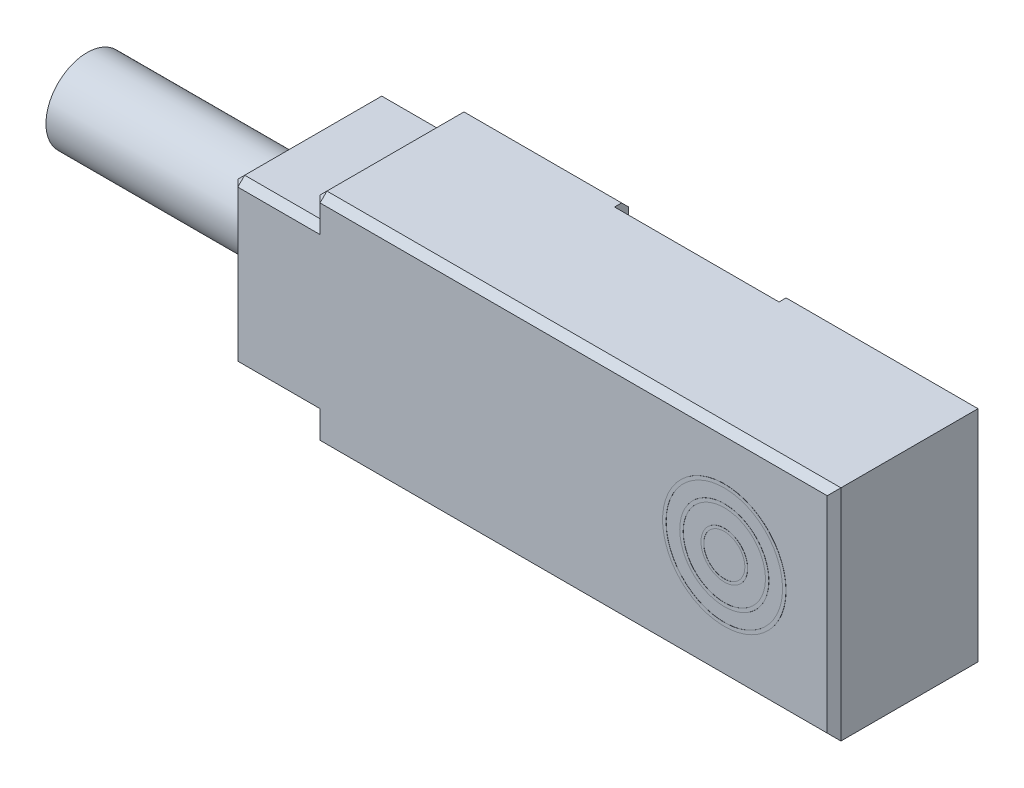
SolidWorks part; units mm, degrees
ref_plane "Front" through (0, 0, 0) normal (0, 0, 1) x (1, 0, 0)
ref_plane "Top" through (0, 0, 0) normal (0, 1, 0) x (1, 0, 0)
ref_plane "Right" through (0, 0, 0) normal (1, 0, 0) x (0, 0, -1)
ref_plane "Plane1" through (0, 0, 2.75) normal (0, 0, 1) x (1, 0, 0)
sketch "Sketch1" plane through (0, 0, 2.75) normal (0, 0, 1) x (1, 0, 0)
  line L0 (14, 4) -> (-8, 4)
  line L1 (-8, 4) -> (-8, -4)
  line L2 (-8, -4) -> (14, -4)
  line L3 (14, -4) -> (14, 4)
extrude "Boss-Extrude1" add sketch "Sketch1" against normal blind 5.5
sketch "Sketch2" plane through (0, 0, -2.75) normal (0, 0, -1) x (-1, 0, 0)
  line L0 (8, 4) -> (5, 4)
  line L1 (5, 4) -> (5, 3)
  line L2 (5, 3) -> (8, 3)
  line L3 (8, 3) -> (8, 4)
extrude "Cut-Extrude1" cut sketch "Sketch2" against normal through all
sketch "Sketch3" plane through (0, 0, -2.75) normal (0, 0, -1) x (-1, 0, 0)
  line L0 (8, -3) -> (5, -3)
  line L1 (5, -3) -> (5, -4)
  line L2 (5, -4) -> (8, -4)
  line L3 (8, -4) -> (8, -3)
extrude "Cut-Extrude2" cut sketch "Sketch3" against normal through all
sketch "Sketch4" plane through (0, 0, -2.75) normal (0, 0, -1) x (-1, 0, 0)
  line L0 (2.625, -4) -> (2.625, -2.5)
  line L1 (2.625, -2.5) -> (1.125, -2.5)
  line L2 (1.125, -2.5) -> (1.125, -4)
  line L3 (1.125, -4) -> (2.625, -4)
extrude "Cut-Extrude3" cut sketch "Sketch4" against normal blind 3
sketch "Sketch5" plane through (0, -4, 0) normal (0, -1, 0) x (1, 0, 0)
  line L0 (7, -2.75) -> (7, -0.25)
  line L1 (7, -0.25) -> (1, -0.25)
  line L2 (1, -0.25) -> (1, -2.75)
  line L3 (1, -2.75) -> (7, -2.75)
extrude "Cut-Extrude4" cut sketch "Sketch5" against normal blind 1.75
sketch "Sketch6" plane through (0, 0, 2.75) normal (0, 0, 1) x (1, 0, 0)
  circle A0 centre (10, 0) radius 2.25
extrude "Boss-Extrude2" add sketch "Sketch6" along normal blind 0.005
sketch "Sketch7" plane through (0, 0, 2.755) normal (0, 0, 1) x (1, 0, 0)
  circle A0 centre (10, 0) radius 2.125
extrude "Cut-Extrude5" cut sketch "Sketch7" against normal blind 0.005
sketch "Sketch8" plane through (0, 0, 2.75) normal (0, 0, 1) x (1, 0, 0)
  circle A0 centre (10, 0) radius 1.625
extrude "Boss-Extrude3" add sketch "Sketch8" along normal blind 0.005
sketch "Sketch9" plane through (0, 0, 2.755) normal (0, 0, 1) x (1, 0, 0)
  circle A0 centre (10, 0) radius 1.5
extrude "Cut-Extrude6" cut sketch "Sketch9" against normal blind 0.005
sketch "Sketch10" plane through (0, 0, 0) normal (0, 0, 1) x (1, 0, 0)
  line L0 (-16, 1.5) -> (-16, 0)
  line L1 (-16, 0) -> (-8, 0)
  line L2 (-8, 0) -> (-8, 1.5)
  line L3 (-8, 1.5) -> (-16, 1.5)
  line L4 (-16, 0) -> (-8, 0) construction
revolve "Revolve1" add sketch "Sketch10" angle 360 about L4
sketch "Sketch11" plane through (0, 0, 0) normal (0, 1, 0) x (1, 0, 0)
  line L0 (10.85, -2.75) -> (10, -2.75)
  line L1 (10, -2.75) -> (10, -2.755)
  line L2 (10, -2.755) -> (10.85, -2.755)
  line L3 (10.85, -2.755) -> (10.85, -2.75)
  line L4 (10, -2.75) -> (10, -2.755) construction
revolve "Revolve2" add sketch "Sketch11" angle 360 about L4
sketch "Sketch12" plane through (0, 0, 0) normal (0, 1, 0) x (1, 0, 0)
  line L0 (10.75, -2.75) -> (10, -2.75)
  line L1 (10, -2.75) -> (10, -2.755)
  line L2 (10, -2.755) -> (10.75, -2.755)
  line L3 (10.75, -2.755) -> (10.75, -2.75)
  line L4 (10, -2.75) -> (10, -2.755) construction
revolve "Cut-Revolve1" cut sketch "Sketch12" angle 360 about L4
chamfer "Chamfer1" distance 0.25 angle 45 22 edges at (10.5, -4, -2.75) (14, 0, -2.75) (4.5, 4, -2.75) (-5, -3.5, -2.75) (-6.5, -3, -2.75) (-8, 3, 0) (-5, 4, 0) (-5, 3.5, 2.75) (-6.5, 3, 2.75) (-8, 0, 2.75) (4.5, 4, 2.75) (14, 0, 2.75) (4.5, -4, 2.75) (-3.8125, -4, -2.75) (-5, -4, 0) (-5, -3.5, 2.75) (-6.5, -3, 2.75) (-8, -3, 0) (-5, 3.5, -2.75) (-6.5, 3, -2.75) (-8, 0, -2.75) (-0.0625, -4, -2.75)
sketch "Sketch13" plane through (0, 0, -2.75) normal (0, 0, -1) x (-1, 0, 0)
  line L0 (-14, 4) -> (4.75, 4) construction
  line L1 (-7, -2.25) -> (-1, -2.25)
  line L2 (-7, -2.25) -> (-7, 4)
  line L3 (-7, 4) -> (-1, 4)
  line L4 (-1, -2.25) -> (-1, 4)
extrude "Cut-Extrude7" cut sketch "Sketch13" against normal blind 0.508
